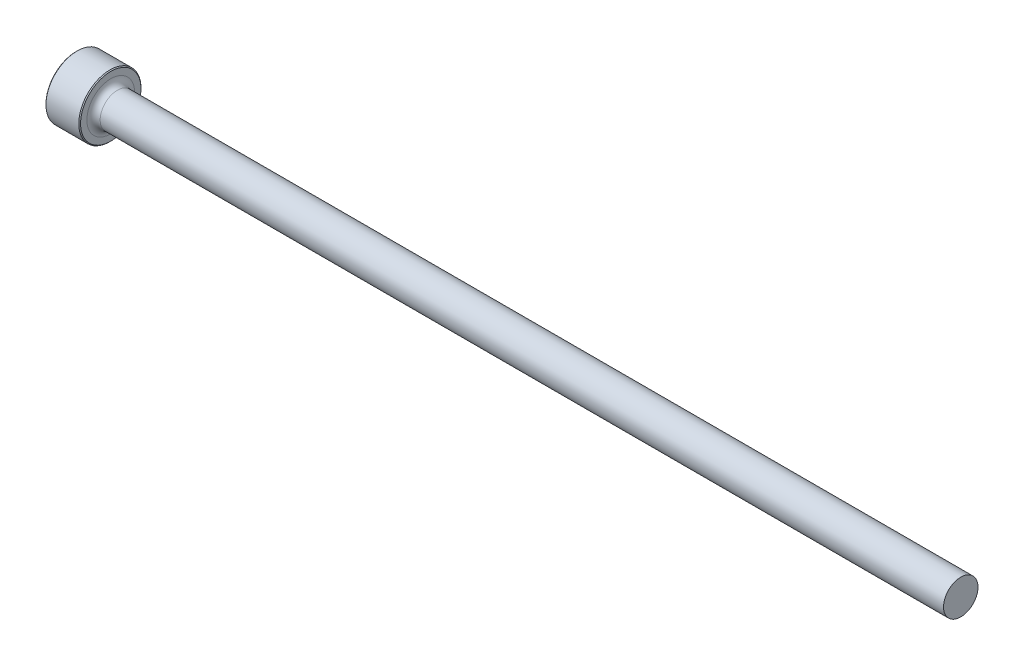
SolidWorks part; units mm, degrees
ref_plane "Front Plane" through (0, 0, 0) normal (0, 0, 1) x (1, 0, 0)
ref_plane "Top Plane" through (0, 0, 0) normal (0, 1, 0) x (1, 0, 0)
ref_plane "Right Plane" through (0, 0, 0) normal (1, 0, 0) x (0, 0, -1)
sketch "Sketch1" plane through (0, 0, 0) normal (0, 0, 1) x (1, 0, 0)
  line L0 (0, 0) -> (0, 3.5719)
  line L1 (0, 3.5719) -> (3.9688, 3.5719)
  line L2 (3.9688, 3.5719) -> (3.9688, 2.7426)
  line L3 (4.7307, 1.9806) -> (101.6, 1.9806)
  line L4 (101.6, 1.9806) -> (101.6, 0)
  line L5 (101.6, 0) -> (0, 0)
  line L6 (101.6, 0) -> (101.6, -1.9806) construction
  line L7 (101.6, -1.9806) -> (3.9688, -1.9806) construction
  line L8 (0, 0) -> (0, -3.5719) construction
  line L9 (0, -3.5719) -> (3.9688, -3.5719) construction
  line L10 (3.9688, -3.5719) -> (3.9688, -1.9806) construction
  arc A0 (3.9688, 2.7426) -> (4.7307, 1.9806) centre (4.7307, 2.7426) ccw
  dimension "D4" = 0.762
  dimension "L" = 101.6
  dimension "D" = 3.9611
  dimension "H" = 7.1437
  dimension "T" = 3.9688
revolve "Revolve1" add sketch "Sketch1" angle 360 about L5
chamfer "Chamfer1" distance 0.1016 angle 45 2 edges at (0, 3.5719, 0) (3.9687, 3.5719, 0)
